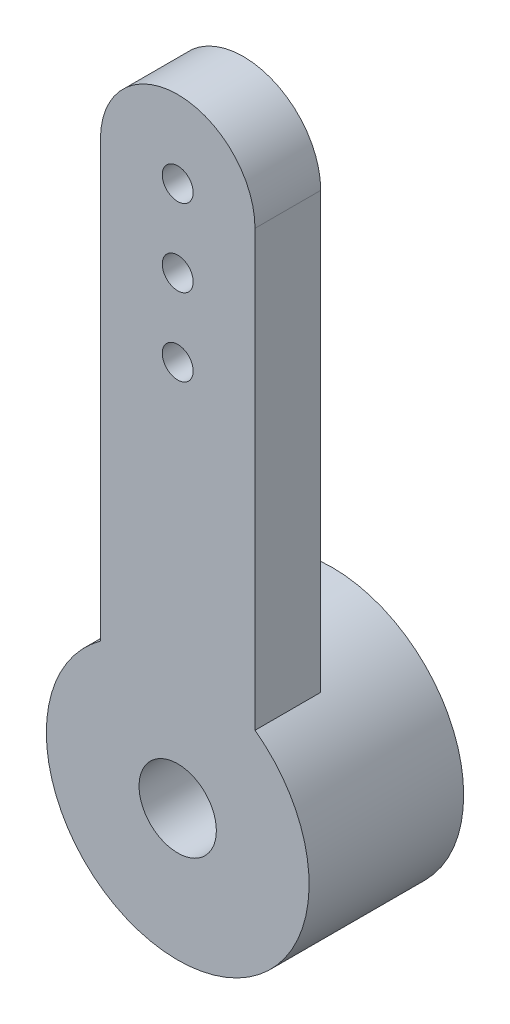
SolidWorks part; units mm, degrees
ref_plane "Plan de face" through (0, 0, 0) normal (0, 0, 1) x (1, 0, 0)
ref_plane "Plan de dessus" through (0, 0, 0) normal (0, 1, 0) x (1, 0, 0)
ref_plane "Plan de droite" through (0, 0, 0) normal (1, 0, 0) x (0, 0, -1)
sketch "Esquisse1" plane through (0, 0, 0) normal (0, 0, 1) x (1, 0, 0)
  line L0 (0, -4.6029) -> (0, 16.0887) construction
  line L1 (13.6544, 0) -> (-4.829, 0) construction
  line L2 (13.6544, 14) -> (-4.829, 14) construction
  line L3 (2, -4.6029) -> (2, 16.0887) construction
  line L4 (2, 14) -> (2, 2.7495)
  line L5 (-2, 14) -> (-2, 2.7495)
  arc A0 (-2, 2.7495) -> (2, 2.7495) centre (0, 0) ccw
  circle A1 centre (0, 0) radius 1
  arc A2 (2, 14) -> (-2, 14) centre (0, 14) ccw
  circle A3 centre (0, 14) radius 0.4
  circle A4 centre (0, 12) radius 0.4
  circle A5 centre (0, 10) radius 0.4
  dimension "D1" = 2
  dimension "D2" = 14
  dimension "D3" = 3
extrude "Boss.-Extru.1" add sketch "Esquisse1" along normal blind 1.7
sketch "Esquisse2" plane through (0, 0, 0) normal (0, 0, -1) x (-1, 0, 0)
  circle A0 centre (0, 0) radius 3.4
  circle A1 centre (0, 0) radius 2.4
extrude "Boss.-Extru.2" add sketch "Esquisse2" along normal blind 2.3
